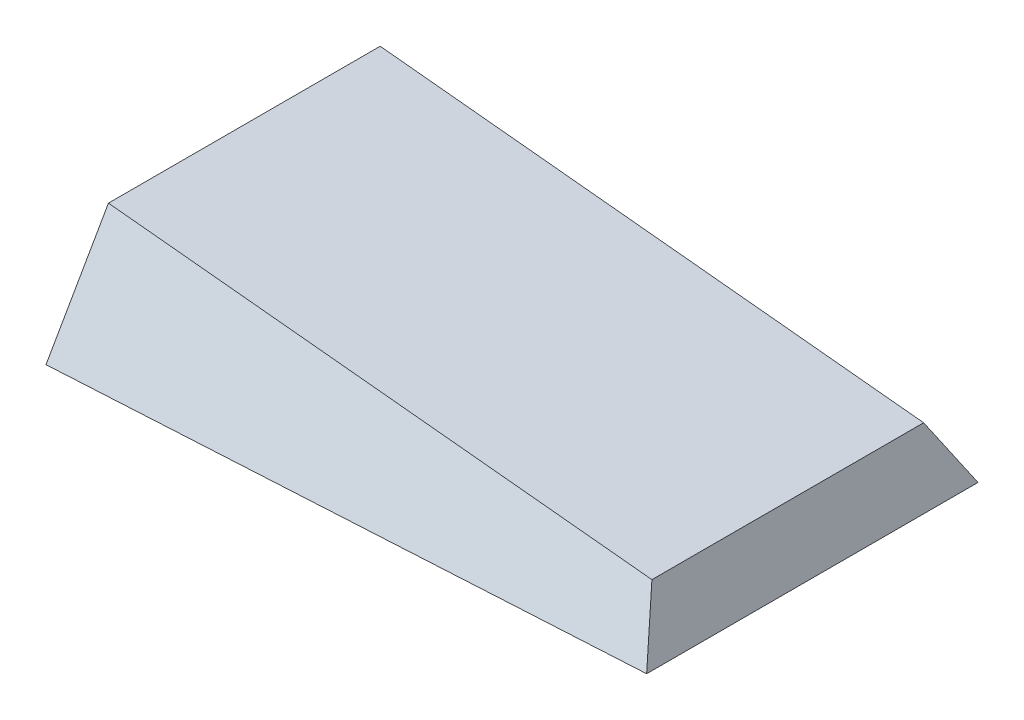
SolidWorks part; units mm, degrees
ref_plane "Front Plane" through (0, 0, 0) normal (0, 0, 1) x (1, 0, 0)
ref_plane "Top Plane" through (0, 0, 0) normal (0, 1, 0) x (1, 0, 0)
ref_plane "Right Plane" through (0, 0, 0) normal (1, 0, 0) x (0, 0, -1)
sketch "Sketch1" plane through (0, 0, 0) normal (0, 0, 1) x (1, 0, 0)
  line L0 (0, 0) -> (-100, 0)
  line L1 (-100, 0) -> (-100, 20)
  line L2 (-100, 20) -> (0, 10)
  line L3 (0, 10) -> (0, 0)
  dimension "D1" = 10
  dimension "D2" = 20
  dimension "D3" = 100
extrude "Extrude1" add sketch "Sketch1" along normal mid plane 50
draft "Draft1" type of draft neutral plane draft angle 30 faces to draft 3 parameters "D1"=30
